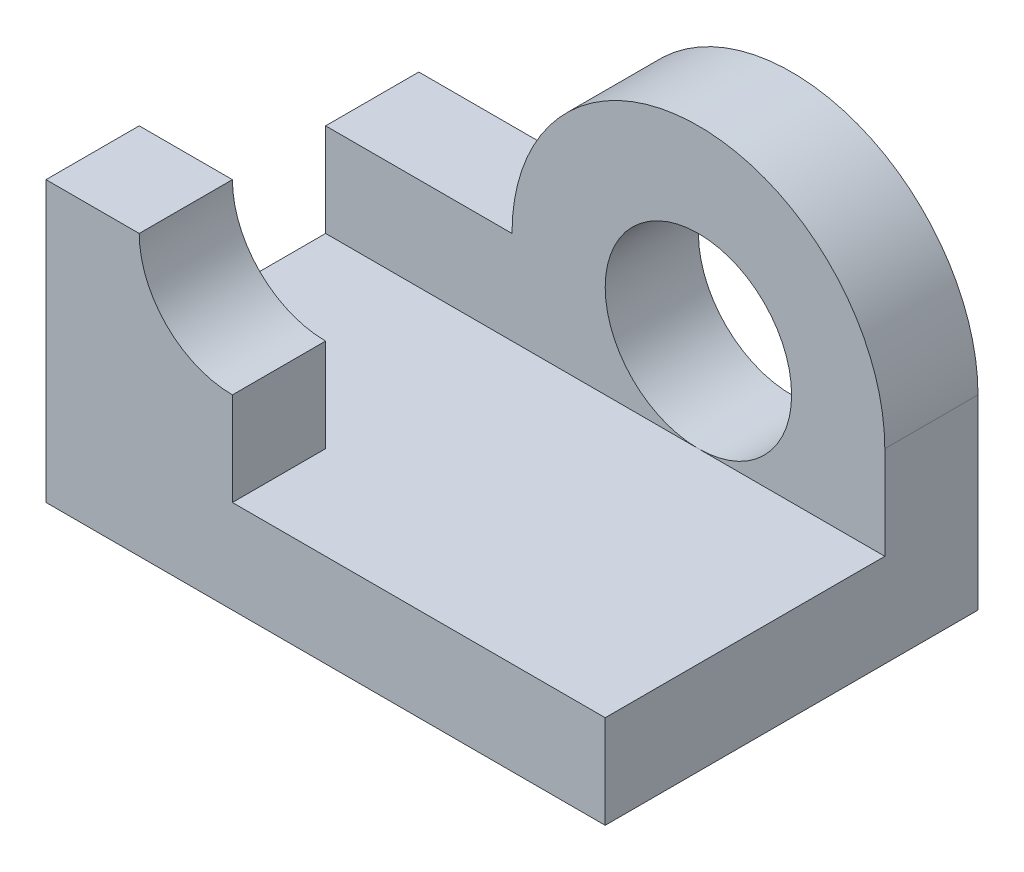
SolidWorks part; units mm, degrees
ref_plane "Front Plane" through (0, 0, 0) normal (0, 0, 1) x (1, 0, 0)
ref_plane "Top Plane" through (0, 0, 0) normal (0, 1, 0) x (1, 0, 0)
ref_plane "Right Plane" through (0, 0, 0) normal (1, 0, 0) x (0, 0, -1)
sketch "Sketch1" plane through (0, 0, 0) normal (0, 1, 0) x (1, 0, 0)
  line L1 (0, 0) -> (60, 0)
  line L2 (0, 0) -> (0, 40)
  line L3 (0, 40) -> (60, 40)
  line L4 (60, 0) -> (60, 40)
  dimension "D1" = 40
  dimension "D2" = 60
extrude "Extrude1" add sketch "Sketch1" along normal blind 10
sketch "Sketch2" plane through (0, 0, 0) normal (0, 0, 1) x (1, 0, 0)
  line L0 (0, 10) -> (0, 30)
  line L1 (0, 30) -> (10, 30)
  line L2 (10, 30) -> (10, 20)
  line L3 (10, 20) -> (20, 20)
  line L4 (20, 20) -> (20, 10)
  line L5 (0, 10) -> (60, 10) construction
  line L6 (0, 10) -> (20, 10)
  dimension "D1" = 10
  dimension "D2" = 10
  dimension "D3" = 20
  dimension "D4" = 20
extrude "Extrude2" add sketch "Sketch2" against normal blind 10
fillet "Fillet1" radius 10 1 edges at (10, 20, -5)
sketch "Sketch3" plane through (0, 0, -40) normal (0, 0, -1) x (-1, 0, 0)
  line L0 (0, 0) -> (0, 20)
  line L1 (0, 20) -> (-20, 20)
  line L2 (-60, 20) -> (-60, 0)
  line L3 (-60, 0) -> (0, 0)
  arc A0 (-20, 20) -> (-60, 20) centre (-40, 20) ccw
  circle A1 centre (-40, 20) radius 10
  dimension "D1" = 20
  dimension "D3" = 40
  dimension "D2" = 20
extrude "Extrude4" add sketch "Sketch3" against normal blind 10
